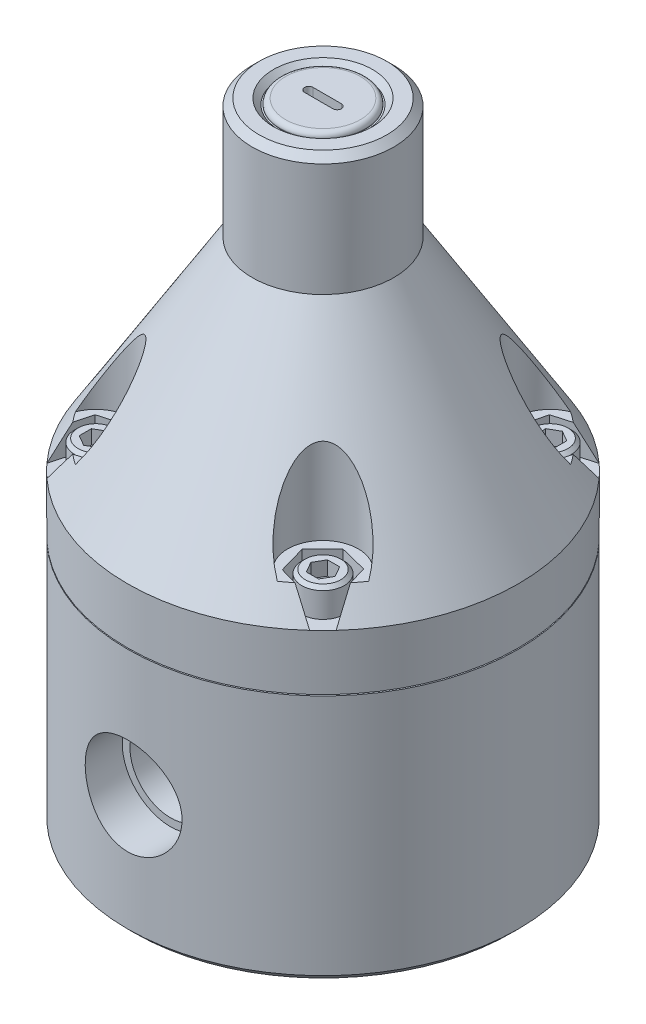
SolidWorks part; units mm, degrees
ref_plane "Front Plane" through (0, 0, 0) normal (0, 0, 1) x (1, 0, 0)
ref_plane "Top Plane" through (0, 0, 0) normal (0, 1, 0) x (1, 0, 0)
ref_plane "Right Plane" through (0, 0, 0) normal (1, 0, 0) x (0, 0, -1)
sketch "Sketch1" plane through (0, 0, 0) normal (0, 1, 0) x (1, 0, 0)
  circle A0 centre (0, 0) radius 43.815
  dimension "D1" = 87.63
extrude "Extrude1" add sketch "Sketch1" along normal blind 140.97
sketch "Sketch2" plane through (0, 0, 0) normal (0, 0, 1) x (1, 0, 0)
  line L0 (0, 0) -> (0, 140.97) construction
  line L1 (43.815, 140.97) -> (-43.815, 140.97) construction
  line L2 (-43.815, 56.134) -> (-43.815, 68.58)
  line L3 (-43.815, 56.134) -> (-30.226, 56.134)
  line L4 (-30.226, 56.134) -> (-30.226, 55.88)
  line L6 (-30.226, 55.88) -> (-49.4473, 55.88)
  line L7 (-49.4473, 55.88) -> (-49.4473, 147.034)
  line L8 (-49.4473, 147.034) -> (-15.875, 147.034)
  line L9 (-15.875, 147.034) -> (-15.875, 114.046)
  line L10 (-15.875, 114.046) -> (-43.815, 68.58)
  line L12 (-43.815, 0) -> (43.815, 0) construction
  dimension "D1" = 43.815
  dimension "D2" = 55.88
  dimension "D3" = 0.254
  dimension "D4" = 30.226
  dimension "D5" = 15.875
  dimension "D6" = 68.58
  dimension "D7" = 26.924
revolve "Cut-Revolve1" cut sketch "Sketch2" angle 360 about L0
ref_plane "Plane1" through (0, 140.97, 0) normal (0, 1, 0) x (-1, 0, 0)
sketch "Sketch3" plane through (0, 140.97, 0) normal (0, 1, 0) x (-1, 0, 0)
  circle A0 centre (0, 0) radius 11.1125
  dimension "D1" = 22.225
extrude "Extrude2" cut sketch "Sketch3" against normal blind 1.27 draft 45
chamfer "Chamfer1" distance 1.5748 angle 45 2 edges at (0, 0, 43.815) (0, 140.97, 15.875)
sketch "Sketch4" plane through (0, 140.97, 0) normal (0, 1, 0) x (-1, 0, 0)
  circle A0 centre (0, 0) radius 9.525
  dimension "D1" = 19.05
extrude "Extrude3" add sketch "Sketch4" against normal up to surface (1.27 mm away)
fillet "Fillet1" radius 1.143 1 edges at (0, 140.97, 9.525)
sketch "Sketch5" plane through (0, 140.97, 0) normal (0, 1, 0) x (-1, 0, 0)
  line L0 (-3.175, 0) -> (3.175, 0) construction
  line L1 (3.175, 0.9652) -> (-3.175, 0.9652)
  line L2 (-3.175, -0.9652) -> (3.175, -0.9652)
  arc A0 (-3.175, 0.9652) -> (-3.175, -0.9652) centre (-3.175, 0) ccw
  arc A1 (3.175, -0.9652) -> (3.175, 0.9652) centre (3.175, 0) ccw
  dimension "D1" = 3.175
  dimension "D2" = 6.35
  dimension "D3" = 0.9652
  dimension "D4" = 0.9652
extrude "Extrude4" cut sketch "Sketch5" against normal blind 3.302 draft 1
ref_plane "Plane2" through (0, 74.93, 0) normal (0, 1, 0) x (-1, 0, 0)
sketch "Sketch6" plane through (0, 74.93, 0) normal (0, 1, 0) x (-1, 0, 0)
  line L0 (0, 0) -> (-43.815, 0) construction
  line L1 (0, 0) -> (-30.9819, 30.9819) construction
  circle A0 centre (0, 0) radius 43.815 construction
  circle A1 centre (0, 0) radius 36.0045 construction
  circle A2 centre (-25.459, 25.459) radius 7.9375
  dimension "D1" = 72.009
  dimension "D2" = 15.875
extrude "Extrude5" cut sketch "Sketch6" along normal blind 22.86
sketch "Sketch8" plane through (0, 74.93, 0) normal (0, 1, 0) x (-1, 0, 0)
  line L0 (0, 0) -> (-30.9819, 30.9819) construction
  line L1 (-30.9819, 19.758) -> (-19.9362, 31.1601) construction
  line L2 (-30.9819, 30.9819) -> (-39.3973, 39.3973) construction
  line L3 (-29.9486, 20.8246) -> (-23.6903, 19.2537)
  line L4 (-23.6903, 19.2537) -> (-19.2007, 23.8882)
  line L5 (-19.2007, 23.8882) -> (-20.9694, 30.0935)
  line L9 (-29.9486, 20.8246) -> (-33.5917, 33.5917)
  line L10 (-33.5917, 33.5917) -> (-20.9694, 30.0935)
  line L12 (-27.2278, 31.6643) -> (-31.7174, 27.0299)
  line L13 (-20.9694, 30.0935) -> (-27.2278, 31.6643)
  line L14 (-31.7174, 27.0299) -> (-29.9486, 20.8246)
  circle A0 centre (0, 0) radius 43.815 construction
  arc A1 (-32.876, 22.6318) -> (-22.6318, 32.876) centre (-25.459, 25.459) ccw construction
  arc A2 (-32.876, 22.6318) -> (-22.6318, 32.876) centre (-25.459, 25.459) ccw construction
  circle A3 centre (-25.459, 25.459) radius 5.588 construction
extrude "Extrude6" cut sketch "Sketch8" against normal blind 6.35
pattern_circular "CirPattern1" count 4 over 360 about axis through (0, 0, 0) along (0, 1, 0) of "Extrude5", "Extrude6"
sketch "Sketch9" plane through (0, 74.93, 0) normal (0, 1, 0) x (-1, 0, 0)
  line L0 (0, 0) -> (-25.459, 25.459) construction
  circle A0 centre (-25.459, 25.459) radius 4.7625
  dimension "D1" = 9.525
extrude "Extrude7" add sketch "Sketch9" against normal up to surface (6.35 mm away)
sketch "Sketch10" plane through (0, 74.93, 0) normal (0, 1, 0) x (-1, 0, 0)
  line L1 (-28.1871, 25.459) -> (-26.8231, 23.0964)
  line L2 (-26.8231, 23.0964) -> (-24.095, 23.0964)
  line L3 (-24.095, 23.0964) -> (-22.7309, 25.459)
  line L4 (-22.7309, 25.459) -> (-24.095, 27.8216)
  line L5 (-24.095, 27.8216) -> (-26.8231, 27.8216)
  line L6 (-26.8231, 27.8216) -> (-28.1871, 25.459)
  circle A0 centre (-25.459, 25.459) radius 2.3626 construction
extrude "Extrude8" cut sketch "Sketch10" against normal blind 3.175
pattern_circular "CirPattern2" count 4 over 360 about axis through (0, 0, 0) along (0, 1, 0) of "Extrude7", "Extrude8"
chamfer "Chamfer2" distance 0.762 angle 45 4 edges at (-25.459, 74.93, -30.2215) (30.2215, 74.93, -25.459) (25.459, 74.93, 30.2215) (-30.2215, 74.93, 25.459)
ref_plane "Plane3" through (0, 0, 43.815) normal (0, 0, 1) x (1, 0, 0)
sketch "Sketch11" plane through (0, 0, 43.815) normal (0, 0, 1) x (1, 0, 0)
  line L0 (0, -6.7756) -> (0, 147.7456) construction
  line L1 (-48.3989, 25.4) -> (47.2148, 25.4) construction
  line L2 (-42.2402, 0) -> (42.2402, 0) construction
  dimension "D1" = 25.4
hole_wizard "CBORE for #00 Binding Head Machine Screw1" positions "3DSketch3" profile "Sketch14" counterbore size "#00" standard "Ansi Inch"
sketch3d "3DSketch3"
  line L0 (0, -6.7756, 43.815) -> (0, 147.7456, 43.815) construction
  point P0 (0, 27.432, 43.815)
sketch "Sketch14" plane through (0, 27.432, 43.815) normal (1, 0, 0) x (0, -1, 0)
  line L0 (0, 0) -> (0, 23.5964)
  line L1 (0, 23.5964) -> (9.1186, 19.05)
  line L2 (9.1186, 19.05) -> (9.1186, 9.652)
  line L3 (9.1186, 9.652) -> (10.8585, 9.652)
  line L4 (10.8585, 9.652) -> (10.8585, 0)
  line L5 (10.8585, 0) -> (0, 0)
  line L10 (0, 23.5964) -> (-9.1186, 19.05) construction
  line L11 (0, -6.35) -> (0, 107.95) construction
  dimension "Hole Dia." = 18.2372
  dimension "Hole Depth" = 19.05
  dimension "C'Bore Dia." = 21.717
  dimension "C'Bore Depth" = 9.652
  dimension "Drill Angle" = 127
mirror "Mirror1" about plane through (0, 0, 0) normal (0, 0, 1) of "CBORE for #00 Binding Head Machine Screw1"
